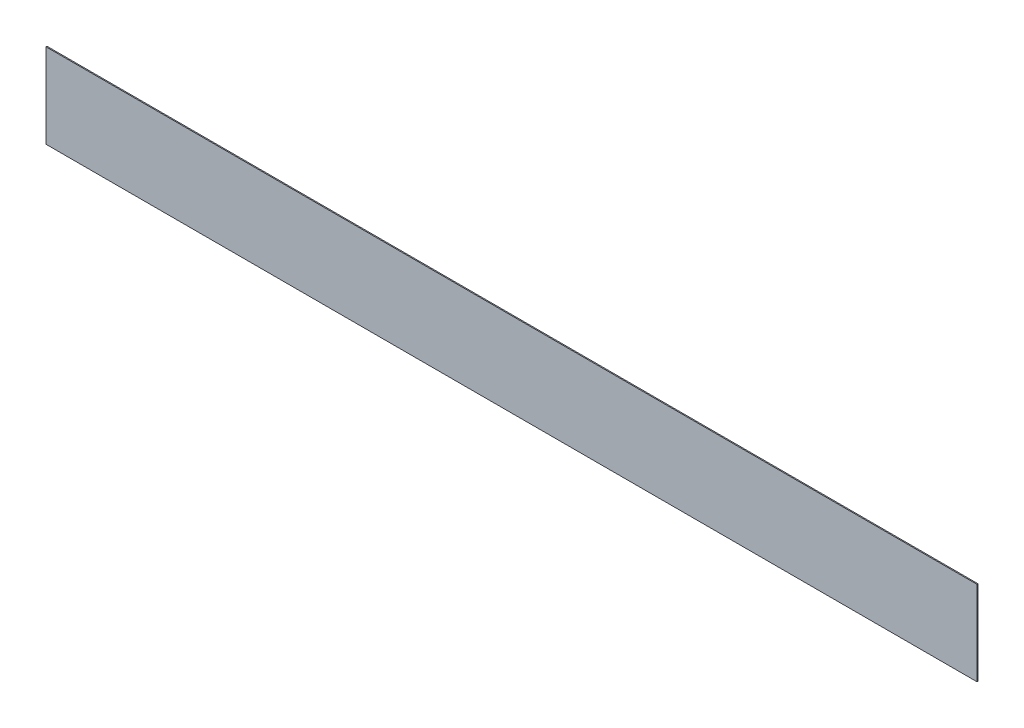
SolidWorks part; units mm, degrees
ref_plane "Plan de face" through (0, 0, 0) normal (0, 0, 1) x (1, 0, 0)
ref_plane "Plan de dessus" through (0, 0, 0) normal (0, 1, 0) x (1, 0, 0)
ref_plane "Plan de droite" through (0, 0, 0) normal (1, 0, 0) x (0, 0, -1)
sketch "Esquisse1" plane through (0, 0, 0) normal (0, 0, 1) x (1, 0, 0)
  line L1 (-118.1311, 38.8524) -> (1701.8689, 38.8524)
  line L2 (-118.1311, 38.8524) -> (-118.1311, -126.1476)
  line L3 (-118.1311, -126.1476) -> (1701.8689, -126.1476)
  line L4 (1701.8689, 38.8524) -> (1701.8689, -126.1476)
  dimension "D1" = 1820
  dimension "D2" = 165
extrude "Boss.-Extru.1" add sketch "Esquisse1" along normal blind 2
